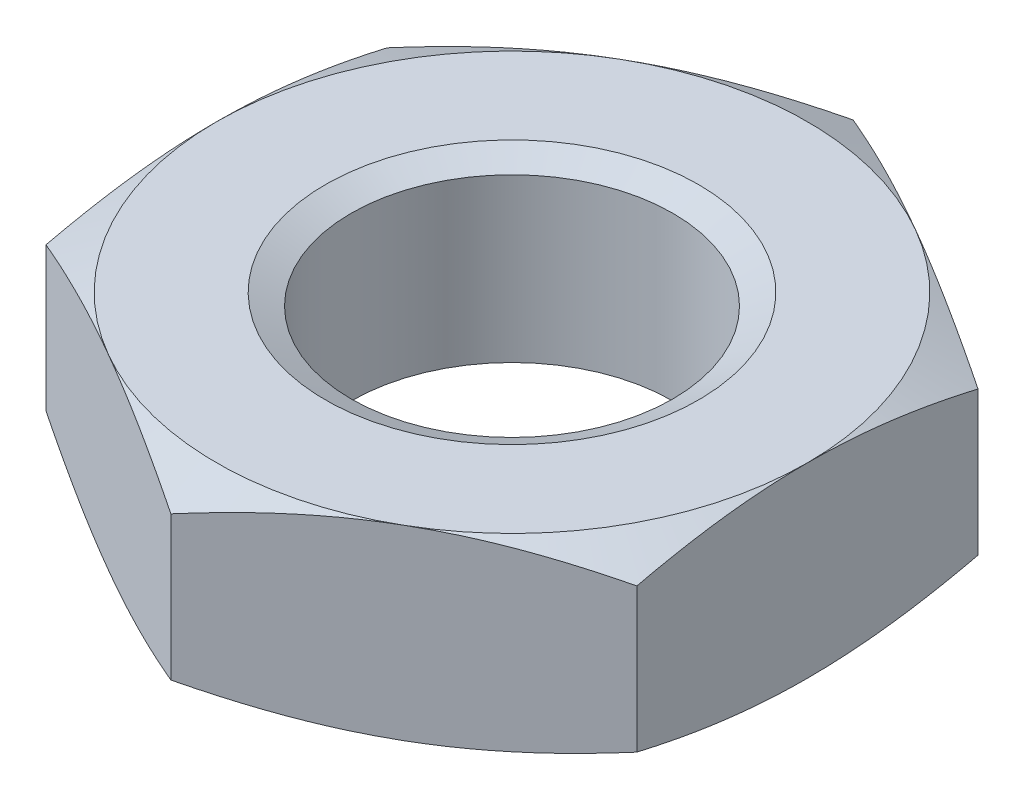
SolidWorks part; units mm, degrees
ref_plane "Front" through (0, 0, 0) normal (0, 0, 1) x (1, 0, 0)
ref_plane "Top" through (0, 0, 0) normal (0, 1, 0) x (1, 0, 0)
ref_plane "Right" through (0, 0, 0) normal (1, 0, 0) x (0, 0, -1)
sketch "Sketch1" plane through (0, 0, 0) normal (0, 1, 0) x (1, 0, 0)
  line L1 (0, 10.9697) -> (-9.5, 5.4848)
  line L2 (-9.5, 5.4848) -> (-9.5, -5.4848)
  line L3 (-9.5, -5.4848) -> (0, -10.9697)
  line L4 (0, -10.9697) -> (9.5, -5.4848)
  line L5 (9.5, -5.4848) -> (9.5, 5.4848)
  line L6 (9.5, 5.4848) -> (0, 10.9697)
  circle A0 centre (0, 0) radius 9.5 construction
  dimension "Hex Flats" = 19
extrude "Extrude1" add sketch "Sketch1" along normal mid plane 6
sketch "Sketch2" plane through (0, 0, 0) normal (1, 0, 0) x (0, 0, -1)
  line L0 (-6, -3) -> (-6, 3) construction
  line L1 (0, -3) -> (6, -3)
  line L2 (0, -3) -> (0, 3)
  line L3 (0, 3) -> (6, 3)
  line L4 (6, -3) -> (6, 3)
  line L5 (-5.4848, 3) -> (5.4848, 3) construction
  line L6 (-5.4848, -3) -> (5.4848, -3) construction
  line L7 (0, -9) -> (0, -3) construction
  dimension "Thread Dia" = 12
sketch "Sketch4" plane through (0, 0, 0) normal (1, 0, 0) x (0, 0, -1)
  line L0 (0, 3) -> (6, 3)
  line L1 (6, 3) -> (5.1732, 2.6144)
  line L2 (5.1732, 2.6144) -> (5.1732, -2.6144)
  line L3 (5.1732, -2.6144) -> (6, -3)
  line L4 (6, -3) -> (0, -3)
  line L5 (0, -3) -> (0, 3)
  line L6 (6, -3) -> (6, 3) construction
  line L7 (0, 3) -> (6, 3) construction
  line L8 (0, -3) -> (6, -3) construction
  line L9 (0, -3) -> (0, 3) construction
  line L10 (0, 3) -> (0, 3.9123) construction
  dimension "D1" = 25
revolve "Cut-Revolve2" cut sketch "Sketch4" angle 360 about L10
sketch "Sketch5" plane through (0, 0, 0) normal (1, 0, 0) x (0, 0, -1)
  line L0 (0, -3) -> (9.5, -3)
  line L1 (9.5, -3) -> (10.9697, -2.3147)
  line L2 (10.9697, -2.3147) -> (10.9697, 2.3147)
  line L3 (10.9697, 2.3147) -> (9.5, 3)
  line L4 (0, 3) -> (0, 4.27)
  line L5 (0, 4.27) -> (12.2397, 4.27)
  line L6 (12.2397, 4.27) -> (12.2397, -4.27)
  line L7 (12.2397, -4.27) -> (0, -4.27)
  line L8 (0, -4.27) -> (0, -3)
  line L9 (9.5, 3) -> (9.5, -3) construction
  line L11 (0, -3) -> (6, -3) construction
  line L12 (9.5, 3) -> (0, 3)
  line L13 (10.9697, 0) -> (12.2397, 0) construction
  line L14 (10.9697, 3) -> (10.9697, -3) construction
  line L15 (0, -3) -> (0, 3) construction
  line L17 (0, 0) -> (9.5, 0) construction
  line L22 (0, 3) -> (6, 3) construction
  dimension "D1" = 25
  dimension "D2" = 1.27
  dimension "D3" = 6
revolve "Cut-Revolve3" cut sketch "Sketch5" angle 360 about L15
